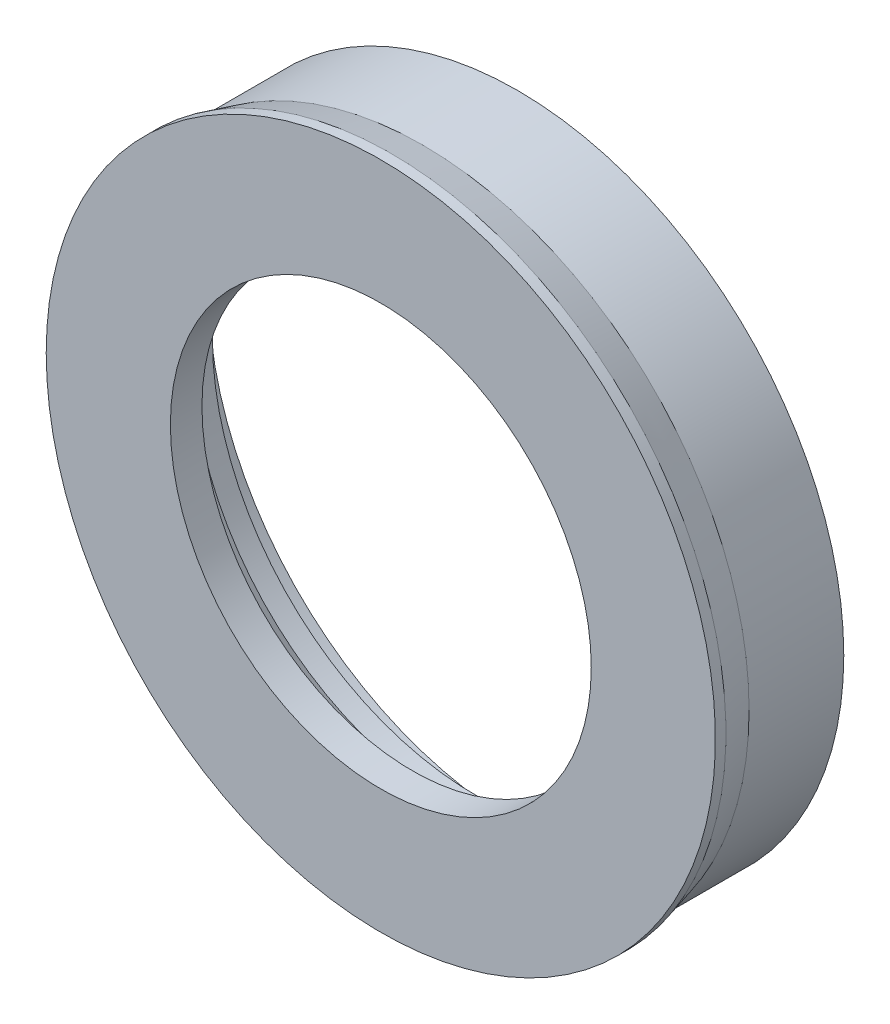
SolidWorks part; units mm, degrees
ref_plane "Plan de face" through (0, 0, 0) normal (0, 0, 1) x (1, 0, 0)
ref_plane "Plan de dessus" through (0, 0, 0) normal (0, 1, 0) x (1, 0, 0)
ref_plane "Plan de droite" through (0, 0, 0) normal (1, 0, 0) x (0, 0, -1)
sketch "Esquisse1" plane through (0, 0, 0) normal (1, 0, 0) x (0, 0, -1)
  line L1 (-1.5, 15.9) -> (-1, 15.9)
  line L2 (-1, 15.9) -> (0.5, 15.5)
  line L3 (0.5, 15.5) -> (5, 15.5)
  line L4 (5, 15.5) -> (5, 14.7)
  line L5 (5, 14.7) -> (3, 14.7)
  line L6 (3, 14.7) -> (3, 12.5)
  line L7 (3, 12.5) -> (2, 12.5)
  line L8 (0, 12.5) -> (1, 12.5)
  line L9 (1, 12.5) -> (1, 12)
  line L10 (1, 12) -> (2, 12.5)
  line L11 (0, 12.5) -> (0, 10)
  line L12 (0, 0) -> (-5.1002, 0) construction
  line L13 (0, 10) -> (-1.5, 10)
  line L14 (-1.5, 10) -> (-1.5, 15.9)
  dimension "D1" = 1
  dimension "D2" = 20
  dimension "D3" = 24
  dimension "D4" = 25
  dimension "D5" = 31.8
  dimension "D6" = 0.5
  dimension "D7" = 2
  dimension "D8" = 6.5
  dimension "D9" = 31
  dimension "D10" = 29.4
  dimension "D11" = 2
  dimension "D12" = 1.5
  dimension "D13" = 2
revolve "Révolution1" add sketch "Esquisse1" angle 360 about L12
